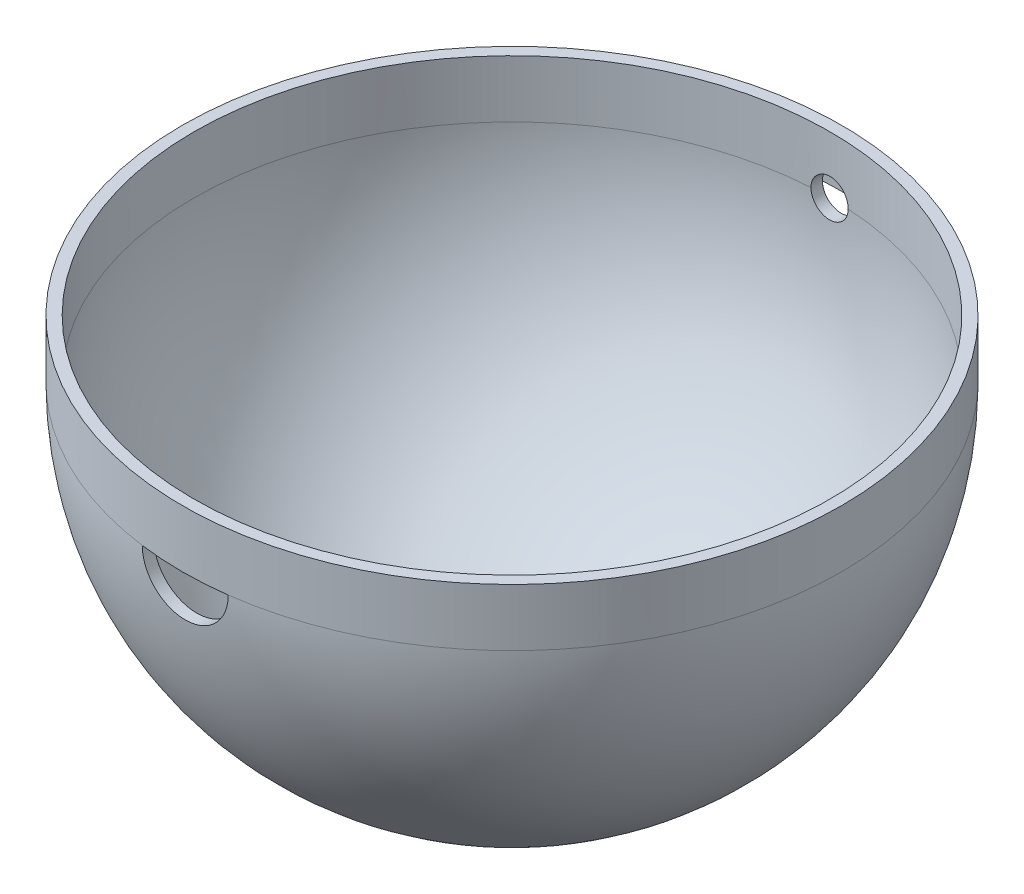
SolidWorks part; units mm, degrees
ref_plane "Plane1" through (0, 0, 0) normal (0, 0, 1) x (1, 0, 0)
ref_plane "Plane2" through (0, 0, 0) normal (0, 1, 0) x (1, 0, 0)
ref_plane "Plane3" through (0, 0, 0) normal (1, 0, 0) x (0, 0, -1)
sketch "Sketch1" plane through (0, 0, 0) normal (0, 0, 1) x (1, 0, 0)
  line L0 (0, -0.635) -> (0, 6.096) construction
  line L1 (0, 69.4822) -> (0, -41.3706) construction
  line L2 (0, 17.78) -> (45.411, 17.78) construction
  arc A0 (0, -11.43) -> (29.21, 17.78) centre (0, 17.78) ccw
  dimension "D1" = 58.42
  dimension "D2" = 17.78
revolve "Scoop Revolve" add sketch "Sketch1" angle 360 about L1
sketch "Sketch4" plane through (0, 17.78, 0) normal (0, 1, 0) x (-1, 0, 0)
  circle A0 centre (0, 0) radius 28.194 construction
  circle A1 centre (0, 0) radius 29.21
  circle A2 centre (0, 0) radius 29.21
  circle A3 centre (0, 0) radius 28.194
  dimension "D1" = 0
extrude "Boss-Extrude1" add sketch "Sketch4" along normal up to surface (5.08 mm away)
sketch "Sketch2" plane through (0, 0, 0) normal (0, 0, 1) x (1, 0, 0)
  circle A1 centre (0, 17.78) radius 3.81
  circle A2 centre (0, 17.78) radius 3.81
  dimension "D1" = 0
extrude "Hole for shaft" cut sketch "Sketch2" along normal up to surface (28.9605 mm away)
sketch "Sketch3" plane through (0, 0, 0) normal (0, 0, 1) x (1, 0, 0)
  circle A0 centre (0, 17.78) radius 1.651
  dimension "D1" = 3.302
extrude "Rivet cut" cut sketch "Sketch3" against normal up to surface (29.1633 mm away)
